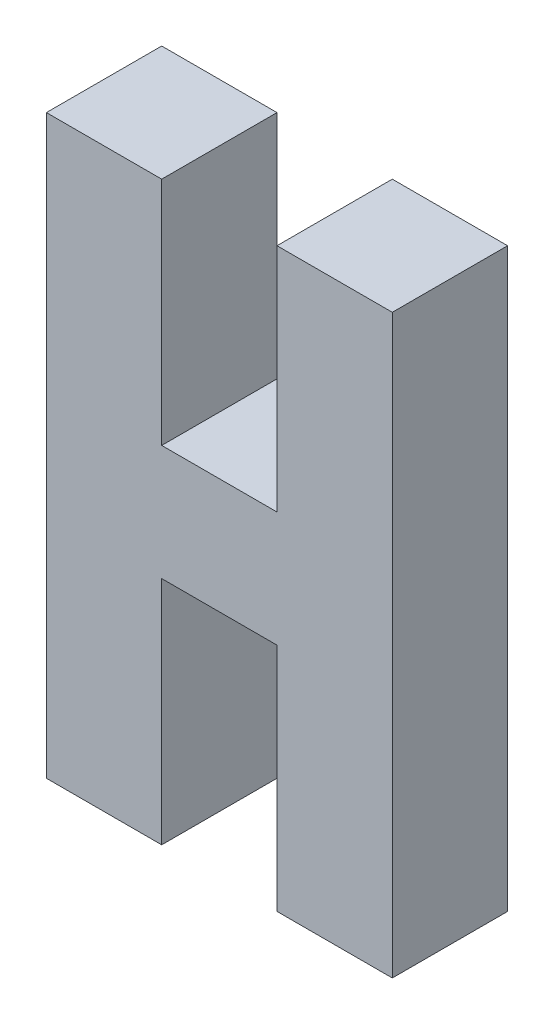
SolidWorks part; units mm, degrees
ref_plane "Plan de face" through (0, 0, 0) normal (0, 0, 1) x (1, 0, 0)
ref_plane "Plan de dessus" through (0, 0, 0) normal (0, 1, 0) x (1, 0, 0)
ref_plane "Plan de droite" through (0, 0, 0) normal (1, 0, 0) x (0, 0, -1)
sketch "Esquisse1" plane through (0, 0, 0) normal (0, 0, 1) x (1, 0, 0)
  line L0 (20, 50) -> (30, 50)
  line L1 (0, 0) -> (10, 0)
  line L2 (0, 0) -> (0, 50)
  line L3 (0, 50) -> (10, 50)
  line L4 (30, 0) -> (30, 50)
  line L5 (20, 0) -> (30, 0)
  line L6 (10, 50) -> (10, 30)
  line L7 (10, 30) -> (20, 30)
  line L8 (20, 50) -> (20, 30)
  line L10 (10, 0) -> (10, 20)
  line L11 (10, 20) -> (20, 20)
  line L12 (20, 0) -> (20, 20)
  dimension "D1" = 50
  dimension "D2" = 30
  dimension "D3" = 10
  dimension "D4" = 10
  dimension "D5" = 10
  dimension "D6" = 10
  dimension "D7" = 10
extrude "Boss.-Extru.1" add sketch "Esquisse1" along normal blind 10
